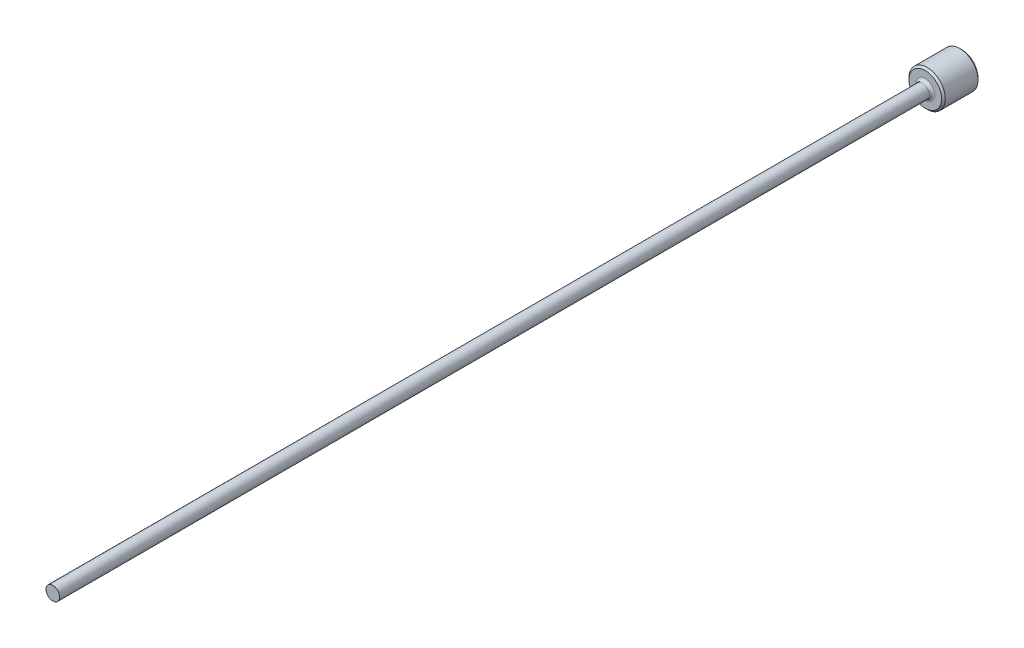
SolidWorks part; units mm, degrees
ref_plane "Front Plane" through (0, 0, 0) normal (0, 0, 1) x (1, 0, 0)
ref_plane "Top Plane" through (0, 0, 0) normal (0, 1, 0) x (1, 0, 0)
ref_plane "Right Plane" through (0, 0, 0) normal (1, 0, 0) x (0, 0, -1)
sketch "Sketch1" plane through (0, 0, 0) normal (1, 0, 0) x (0, 0, -1)
  line L0 (0, 0) -> (0, 2)
  line L1 (0, 2.2) -> (0, -2.2) construction
  line L2 (0, 2) -> (-4, 2)
  line L3 (-4, 2) -> (-4, 1.05)
  line L4 (-4.3, 0.75) -> (-100, 0.75)
  line L5 (-100, 0.75) -> (-100, 0)
  line L6 (2.2, 0) -> (-2.2, 0) construction
  line L7 (-100, 0) -> (0, 0)
  line L8 (-109.0506, 0) -> (16.9928, 0) construction
  arc A0 (-4, 1.05) -> (-4.3, 0.75) centre (-4.3, 1.05) cw
  dimension "D1" = 0.3
  dimension "D2" = 4
  dimension "D3" = 1.5
  dimension "D4" = 100
  dimension "D5" = 4
revolve "Revolve1" add sketch "Sketch1" angle 360 about L8
chamfer "Chamfer1" distance 0.2 angle 45 2 edges at (2, 0, 0) (2, 0, 4)
